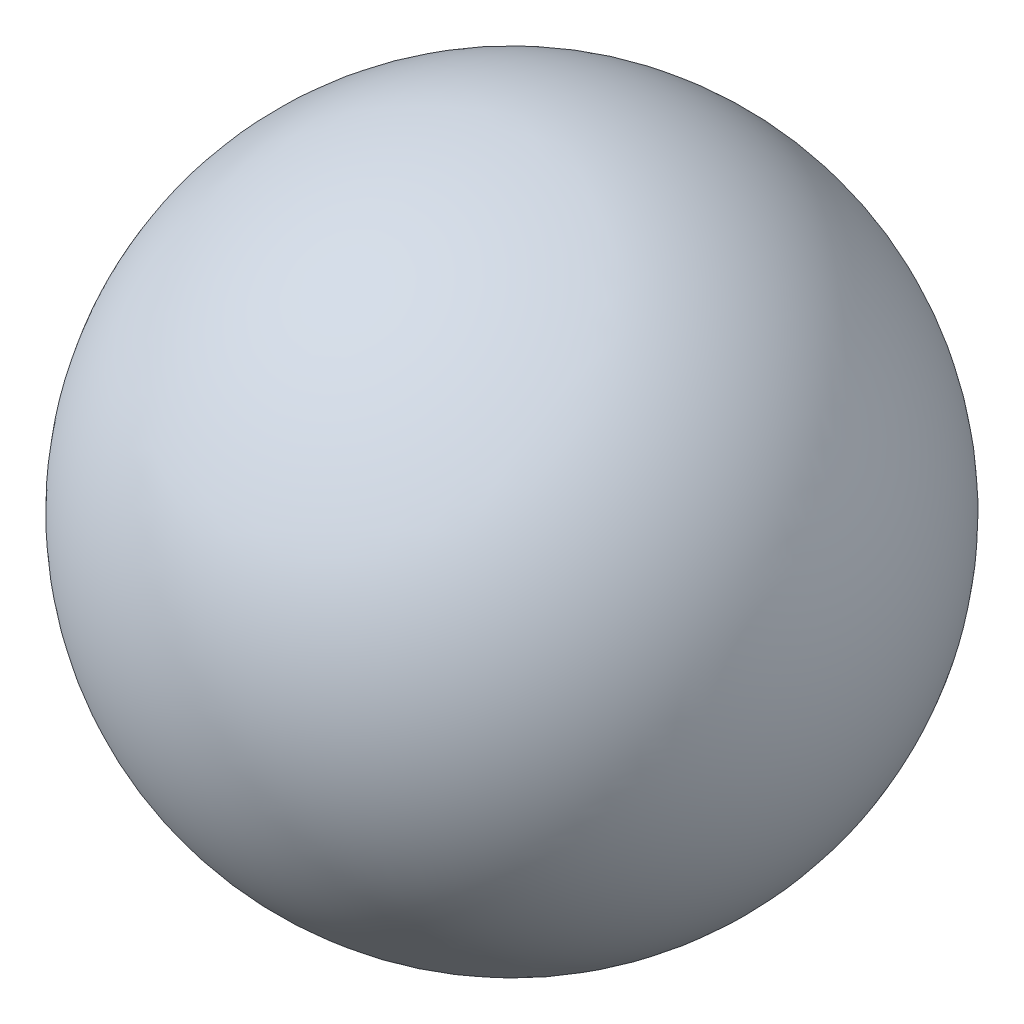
SolidWorks part; units mm, degrees
ref_plane "Alzado" through (0, 0, 0) normal (0, 0, 1) x (1, 0, 0)
ref_plane "Planta" through (0, 0, 0) normal (0, 1, 0) x (1, 0, 0)
ref_plane "Vista lateral" through (0, 0, 0) normal (1, 0, 0) x (0, 0, -1)
sketch "Croquis1" plane through (0, 0, 0) normal (1, 0, 0) x (0, 0, -1)
  line L0 (0, 0) -> (15, 0) construction
  line L1 (0, 0) -> (-15, 0) construction
  line L2 (15, 0) -> (-15, 0)
  arc A0 (15, 0) -> (-15, 0) centre (0, 0) ccw
  dimension "D1" = 30
revolve "Revolución1" add sketch "Croquis1" angle 360 about L2
sketch "Croquis2" plane through (0, 0, 0) normal (1, 0, 0) x (0, 0, -1)
  circle A0 centre (0, 0) radius 7.5
  dimension "D1" = 15
extrude "Cortar-Extruir1" cut sketch "Croquis2" against normal through all
